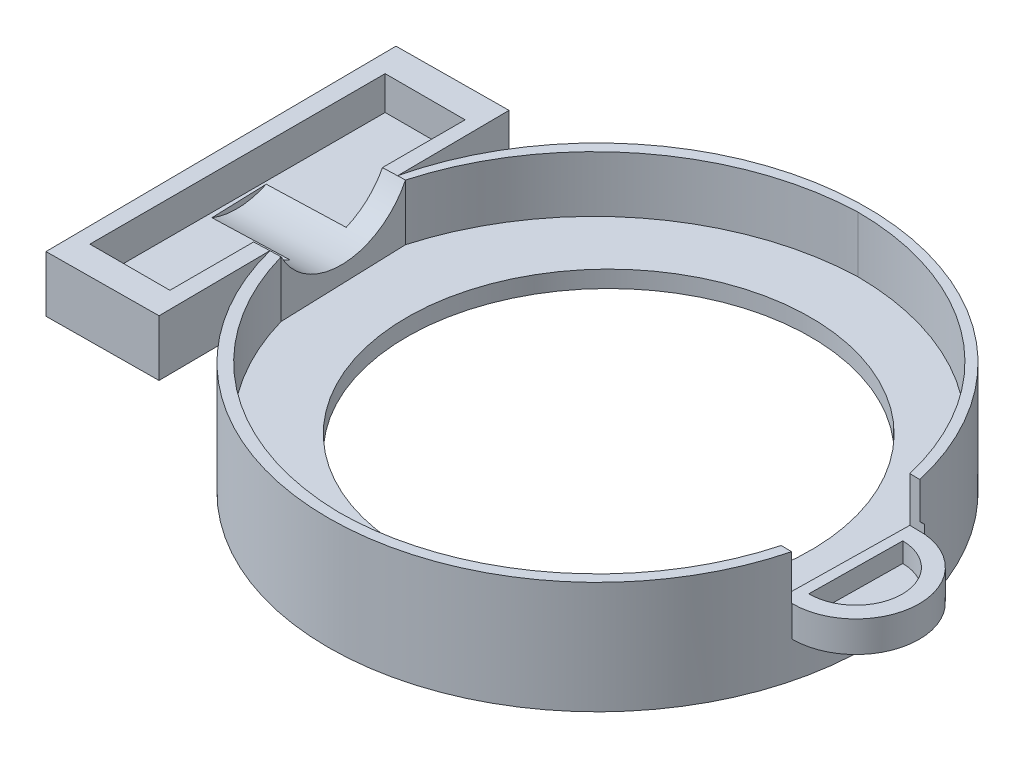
SolidWorks part; units mm, degrees
ref_plane "前视基准面" through (0, 0, 0) normal (0, 0, 1) x (1, 0, 0)
ref_plane "上视基准面" through (0, 0, 0) normal (0, 1, 0) x (1, 0, 0)
ref_plane "右视基准面" through (0, 0, 0) normal (1, 0, 0) x (0, 0, -1)
sketch "草图1" plane through (0, 0, 0) normal (0, 1, 0) x (1, 0, 0)
  circle A0 centre (0, 0) radius 18
  circle A1 centre (-1, 0) radius 23.2
  dimension "D1" = 1
  dimension "D2" = 46.4
  dimension "D3" = 36
extrude "凸台-拉伸1" add sketch "草图1" along normal blind 1.5
sketch "草图2" plane through (0, 1.5, 0) normal (0, 1, 0) x (1, 0, 0)
  circle A0 centre (-1, 0) radius 23.2
  circle A1 centre (-1, 0) radius 24
extrude "凸台-拉伸2" add sketch "草图2" against normal blind 5
sketch "草图3" plane through (0, 0, 0) normal (0, -1, 0) x (-1, 0, 0)
  circle A0 centre (22, 0) radius 1.25
  dimension "D1" = 22
  dimension "D2" = 2.5
extrude "凸台-拉伸3" add sketch "草图3" along normal blind 0.45
sketch "草图4" plane through (0, 1.5, 0) normal (0, 1, 0) x (1, 0, 0)
  line L0 (-23.67, 5.5438) -> (-23.287, -5.9281)
  line L1 (-24.2563, -5.9281) -> (-24.3509, 5.5438)
  line L2 (21.4893, 5.3609) -> (21.3108, -5.9281)
  line L3 (22.3936, 5.3609) -> (22.2563, -5.9281)
  circle A0 centre (-1, 0) radius 24 construction
  arc A1 (-24.3509, 5.5438) -> (-1, 24) centre (-1, 0) cw
  arc A2 (-1, 24) -> (22.3936, 5.3609) centre (-1, 0) cw
  arc A3 (22.2563, -5.9281) -> (-1, -24) centre (-1, 0) cw
  arc A4 (-1, -24) -> (-24.2563, -5.9281) centre (-1, 0) cw
  arc A5 (-23.67, 5.5438) -> (-1, 23.2445) centre (-0.2683, -1.0602) cw
  arc A6 (-1, 23.2445) -> (21.4893, 5.3609) centre (-1.0718, 0.0718) cw
  arc A7 (9.2914, -20.6546) -> (-1.0264, -23.0959) centre (-1.0504, 0.0289) cw
  arc A8 (-1.0264, -23.0959) -> (-23.287, -5.9281) centre (-0.5651, 0.5182) cw
  arc A9 (21.3108, -5.9281) -> (9.2914, -20.6546) centre (-1.0718, 0.0718) cw
extrude "凸台-拉伸4" add sketch "草图4" along normal blind 5
sketch "草图5" plane through (-24.3036, 0, 0.2004) normal (-1, 0, 0.0082) x (0.0082, 0, 1)
  line L0 (23.9918, 6.5) -> (5.7279, 6.5) construction
  line L1 (-15.7444, 6.5) -> (15.7279, 6.5)
  line L2 (-15.7444, 6.5) -> (-15.7444, 1.5)
  line L3 (-15.7444, 1.5) -> (15.7279, 1.5)
  line L4 (15.7279, 6.5) -> (15.7279, 1.5)
  line L5 (-5.7444, 1.5) -> (5.7279, 1.5) construction
  line L6 (5.7279, 6.5) -> (5.7279, 1.5) construction
  line L7 (-5.7444, 6.5) -> (-5.7444, 1.5) construction
  dimension "D1" = 0
  dimension "D2" = 10
  dimension "D3" = 10
extrude "凸台-拉伸5" add sketch "草图5" along normal blind 10
sketch "草图6" plane through (-23.4587, 0, 0.7832) normal (0.9994, 0, -0.0334) x (-0.0334, 0, -0.9994)
  line L3 (-5.1477, 6.5) -> (6.3305, 6.5)
  arc A0 (-5.1477, 6.5) -> (6.3305, 6.5) centre (0.5914, 9.4418) ccw
extrude "切除-拉伸1" cut sketch "草图6" against normal blind 9
sketch "草图7" plane through (0, 6.5, 0) normal (0, 1, 0) x (1, 0, 0)
  line L1 (-32.7913, 12.8551) -> (-25.6575, 12.8551)
  line L2 (-32.7913, 12.8551) -> (-32.7913, -13.4775)
  line L3 (-32.7913, -13.4775) -> (-25.6575, -13.4775)
  line L4 (-25.6575, 12.8551) -> (-25.6575, -13.4775)
extrude "切除-拉伸2" cut sketch "草图7" against normal blind 3
sketch "草图8" plane through (0, 1.5, 0) normal (0, 1, 0) x (1, 0, 0)
  line L0 (22.3936, 5.3609) -> (22.2563, -5.9281)
  arc A0 (22.3936, 5.3609) -> (22.2563, -5.9281) centre (22.325, -0.2836) cw
extrude "凸台-拉伸7" add sketch "草图8" along normal mid plane 3.5
sketch "草图9" plane through (0, 3.25, 0) normal (0, 1, 0) x (1, 0, 0)
  line L0 (22.3752, 3.8497) -> (22.2746, -4.4307)
  line L1 (22.3936, 5.3609) -> (22.2563, -5.9281) construction
  line L2 (22.2563, -5.9281) -> (22.3936, 5.3609) construction
  arc A0 (22.2746, -4.4307) -> (22.3752, 3.8497) centre (22.3249, -0.2905) ccw
extrude "切除-拉伸3" cut sketch "草图9" against normal blind 2.5
sketch "草图10" plane through (21.3992, 0, 0.3385) normal (-0.9999, 0, -0.0158) x (-0.0158, 0, 0.9999)
  line L0 (-5.7001, 6.5) -> (-5.7001, 2.5)
  line L2 (-5.7001, 2.5) -> (5.5903, 2.5)
  line L4 (5.5903, 2.5) -> (5.5903, 6.5)
  line L5 (5.5903, 6.5) -> (-5.7001, 6.5)
  line L7 (5.5903, 1.5) -> (-5.7001, 1.5) construction
  dimension "D1" = 1
extrude "切除-拉伸4" cut sketch "草图10" against normal blind 8
